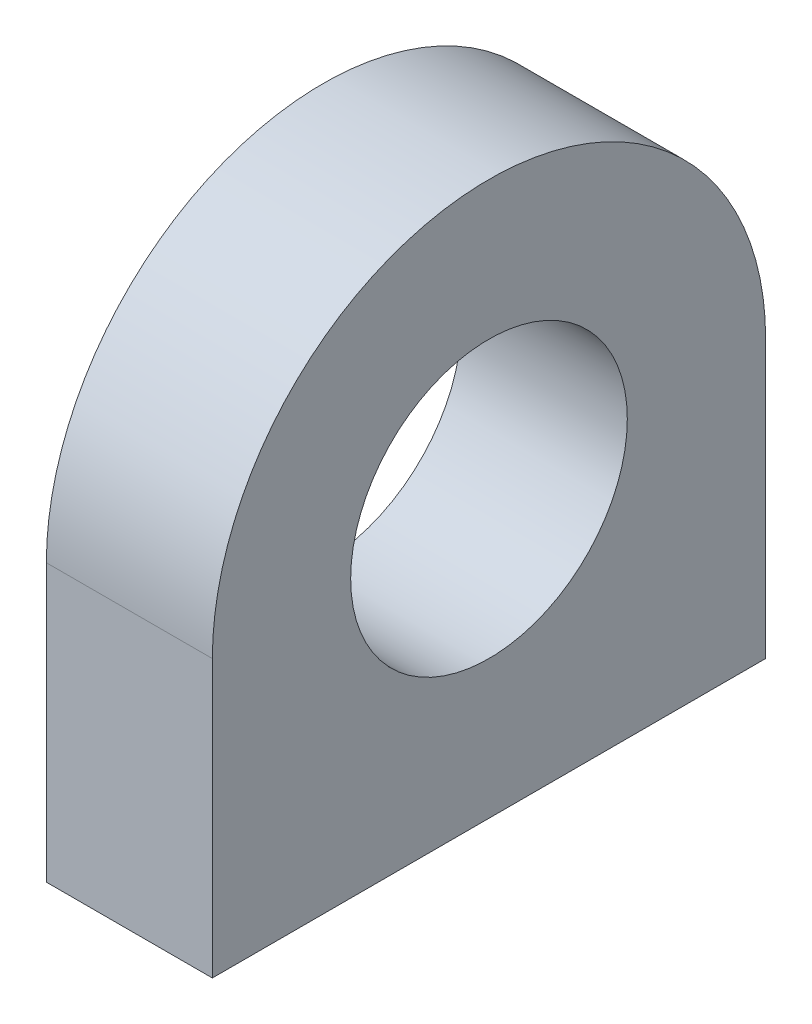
SolidWorks part; units mm, degrees
ref_plane "前视基准面" through (0, 0, 0) normal (0, 0, 1) x (1, 0, 0)
ref_plane "上视基准面" through (0, 0, 0) normal (0, 1, 0) x (1, 0, 0)
ref_plane "右视基准面" through (0, 0, 0) normal (1, 0, 0) x (0, 0, -1)
sketch "Sketch4" plane through (0, 0, 0) normal (1, 0, 0) x (0, 0, -1)
  line L0 (50, 0) -> (-50, 0)
  line L1 (-50, 0) -> (-50, 50)
  line L2 (50, 50) -> (50, 0)
  line L3 (-54.8035, 0) -> (64.5533, 0) construction
  line L4 (0, 0) -> (0, 144.665) construction
  arc A0 (-50, 50) -> (50, 50) centre (0, 50) cw
  circle A1 centre (0, 50) radius 25
  dimension "D1" = 50
  dimension "D3" = 50
extrude "拉伸1" add sketch "Sketch4" along normal blind 30
